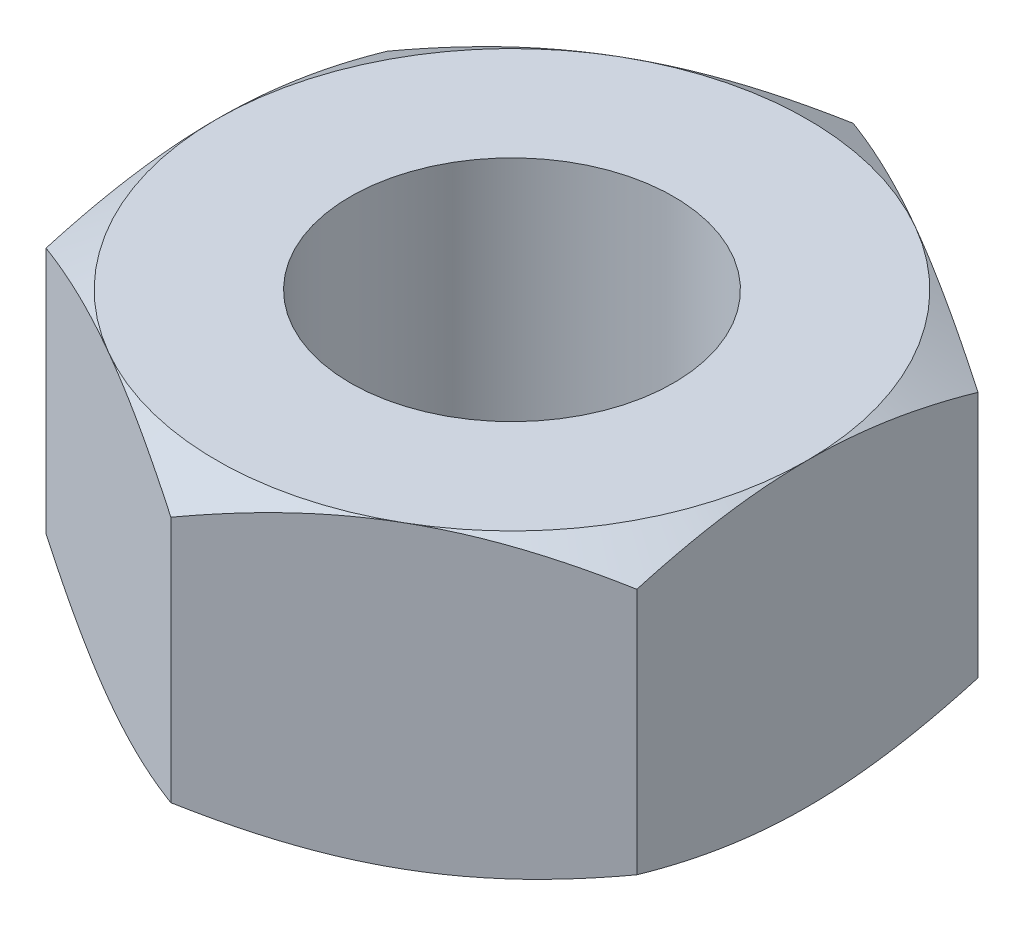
SolidWorks part; units mm, degrees
ref_plane "Front" through (0, 0, 0) normal (0, 0, 1) x (1, 0, 0)
ref_plane "Top" through (0, 0, 0) normal (0, 1, 0) x (1, 0, 0)
ref_plane "Right" through (0, 0, 0) normal (1, 0, 0) x (0, 0, -1)
sketch "Sketch1" plane through (0, 0, 0) normal (0, 1, 0) x (1, 0, 0)
  line L1 (0, 14.7802) -> (-12.8, 7.3901)
  line L2 (-12.8, 7.3901) -> (-12.8, -7.3901)
  line L3 (-12.8, -7.3901) -> (0, -14.7802)
  line L4 (0, -14.7802) -> (12.8, -7.3901)
  line L5 (12.8, -7.3901) -> (12.8, 7.3901)
  line L6 (12.8, 7.3901) -> (0, 14.7802)
  circle A0 centre (0, 0) radius 12.8 construction
  dimension "D1" = 25.6
extrude "Boss-Extrude1" add sketch "Sketch1" along normal mid plane 13
sketch "Sketch2" plane through (0, 6.5, 0) normal (0, 1, 0) x (1, 0, 0)
  line L0 (12.8, -7.3901) -> (12.8, 7.3901) construction
  circle A0 centre (0, 0) radius 12.8
extrude "Cut-Extrude1" cut sketch "Sketch2" against normal blind 10 draft 60 flip side to cut
mirror "Mirror1" about plane through (0, 0, 0) normal (0, 1, 0) of "Cut-Extrude1"
hole_wizard "M16x2.0 Tapped Hole1" positions "Sketch3" profile "Sketch4" tap size "M16x2.0" standard "ANSI Metric"
sketch "Sketch3" plane through (0, 6.5, 0) normal (0, 1, 0) x (-1, 0, 0)
  point P0 (0, 0)
sketch "Sketch4" plane through (0, 6.5, 0) normal (1, 0, 0) x (0, 0, 1)
  line L0 (0, 0) -> (0, 13)
  line L1 (0, 13) -> (7, 13)
  line L2 (7, 13) -> (7, 0)
  line L5 (7, 0) -> (0, 0)
  line L11 (0, -6.35) -> (0, 107.95) construction
  dimension "Thru Tap Drill Dia." = 14
  dimension "Thru Tap Drill Depth" = 13
